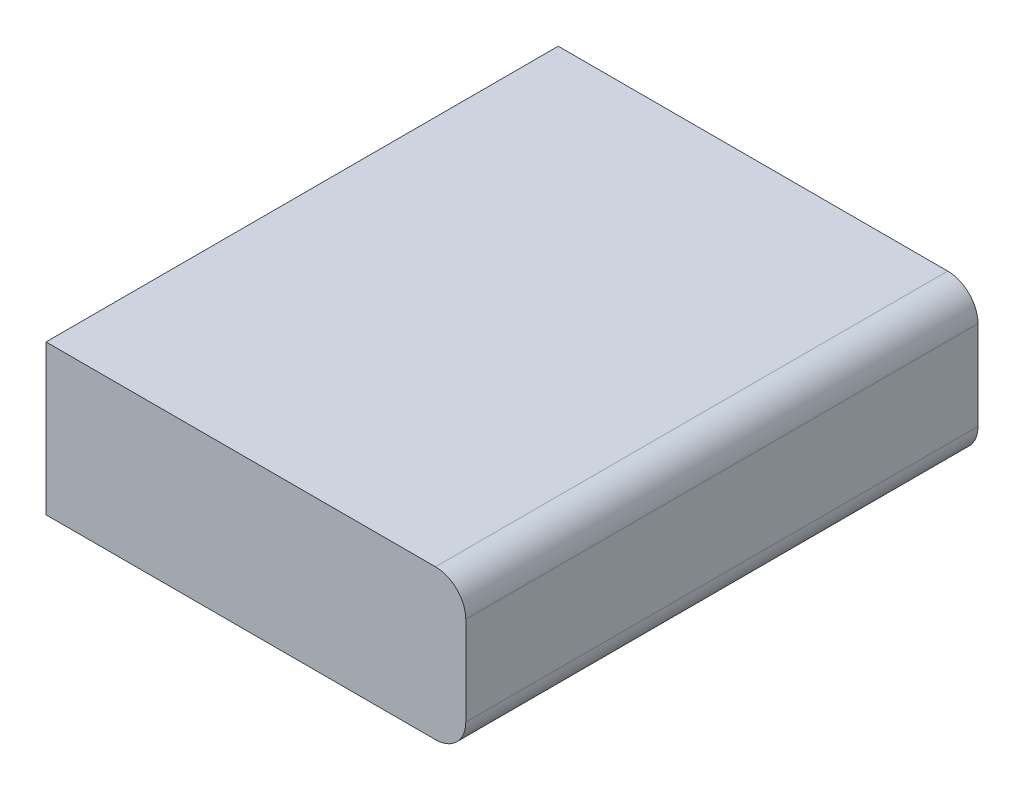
SolidWorks part; units mm, degrees
ref_plane "Front Plane" through (0, 0, 0) normal (0, 0, 1) x (1, 0, 0)
ref_plane "Top Plane" through (0, 0, 0) normal (0, 1, 0) x (1, 0, 0)
ref_plane "Right Plane" through (0, 0, 0) normal (1, 0, 0) x (0, 0, -1)
sketch "Sketch1" plane through (0, 0, 0) normal (0, 0, 1) x (1, 0, 0)
  line L1 (-108.6944, 25.045) -> (29.8056, 25.045)
  line L2 (-108.6944, 25.045) -> (-108.6944, -24.355)
  line L3 (-108.6944, -24.355) -> (29.8056, -24.355)
  line L4 (29.8056, 25.045) -> (29.8056, -24.355)
  point P4 (-49.676, -24.355)
  dimension "D1" = 49.4
  dimension "D2" = 138.5
extrude "Boss-Extrude1" add sketch "Sketch1" along normal blind 169
fillet "Fillet1" radius 10 2 edges at (29.8056, 25.045, 84.5) (29.8056, -24.355, 84.5)
ref_plane "Plane1" through (-108.6944, 0, 0) normal (-1, 0, 0) x (0, 0, 1)
sketch "Sketch2" plane through (-108.6944, 0, 0) normal (-1, 0, 0) x (0, 0, 1)
  line L0 (0, 25.045) -> (0, -24.355) construction
  line L1 (86, 18.045) -> (30, 18.045)
  line L2 (86, 18.045) -> (86, -1.955)
  line L3 (86, -1.955) -> (30, -1.955)
  line L4 (30, 18.045) -> (30, -1.955)
  line L5 (169, 25.045) -> (0, 25.045) construction
  dimension "D1" = 30
  dimension "D2" = 7
  dimension "D3" = 20
  dimension "D4" = 56
extrude "Cut-Extrude2" cut sketch "Sketch2" against normal blind 1
sketch "Sketch3" plane through (-108.6944, 0, 0) normal (-1, 0, 0) x (0, 0, 1)
  circle A0 centre (35, 13.045) radius 3.5
  point P3 (0, 0)
extrude "Cut-Extrude1" cut sketch "Sketch3" against normal blind 10
